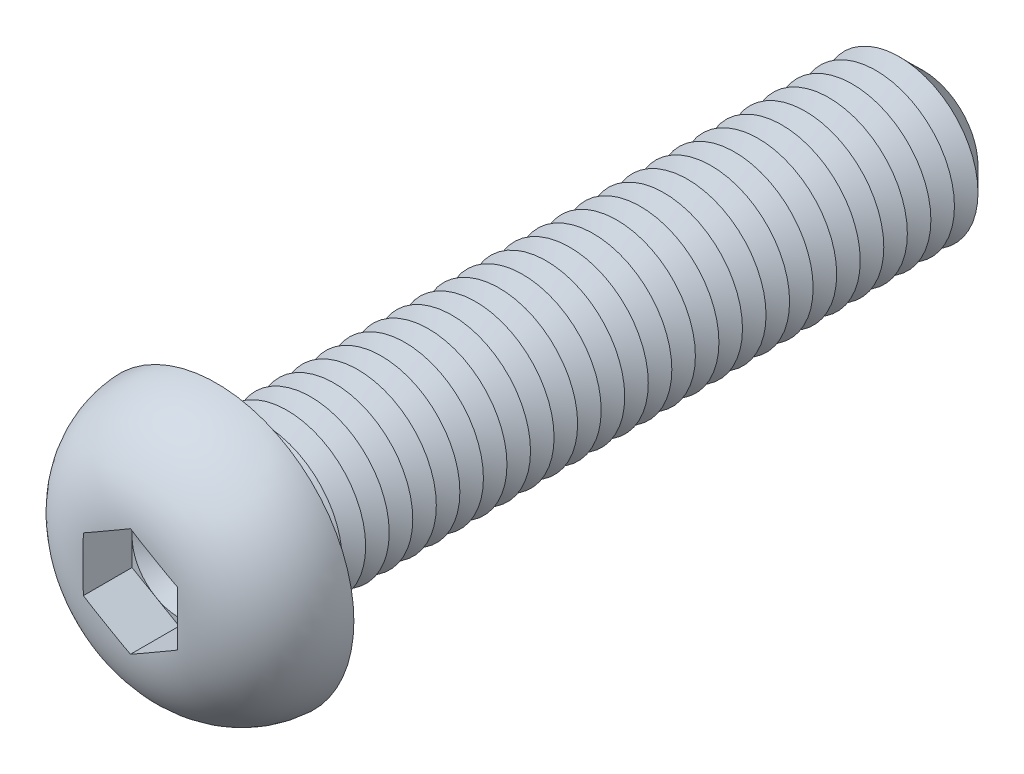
SolidWorks part; units mm, degrees
ref_plane "Front Plane" through (0, 0, 0) normal (0, 0, 1) x (1, 0, 0)
ref_plane "Top Plane" through (0, 0, 0) normal (0, 1, 0) x (1, 0, 0)
ref_plane "Right Plane" through (0, 0, 0) normal (1, 0, 0) x (0, 0, -1)
sketch "Sketch1" plane through (0, 0, 0) normal (1, 0, 0) x (0, 0, -1)
  line L0 (-47.9342, 0) -> (60.3146, 0) construction
sketch "Sketch2" plane through (0, 0, 0) normal (1, 0, 0) x (0, 0, -1)
  line L0 (0, 0) -> (-5.5, 0)
  line L1 (-47.9342, 0) -> (60.3146, 0) construction
  line L2 (-5.5, 0) -> (-5.5, 2.9578)
  line L3 (0, 8.75) -> (0, 0)
  arc A0 (-5.5, 2.9578) -> (0, 8.75) centre (0.3, 2.9578) cw
  dimension "D1" = 5.8
  dimension "D2" = 5.5
  dimension "D3" = 8.75
revolve "Revolve1" add sketch "Sketch2" angle 360 about L0
sketch "Sketch3" plane through (0, 0, 5.5) normal (0, 0, 1) x (1, 0, 0)
  line L1 (0, 3.4641) -> (-3, 1.7321)
  line L2 (-3, 1.7321) -> (-3, -1.7321)
  line L3 (-3, -1.7321) -> (0, -3.4641)
  line L4 (0, -3.4641) -> (3, -1.7321)
  line L5 (3, -1.7321) -> (3, 1.7321)
  line L6 (3, 1.7321) -> (0, 3.4641)
  circle A0 centre (0, 0) radius 3 construction
  dimension "D1" = 6
extrude "Cut-Extrude1" cut sketch "Sketch3" against normal blind 3.12
sketch "Sketch4" plane through (0, 0, 0) normal (0, 0, -1) x (-1, 0, 0)
  circle A0 centre (0, 0) radius 5
  dimension "D1" = 10
extrude "Boss-Extrude1" add sketch "Sketch4" along normal blind 45
chamfer "Chamfer1" distance 1.5 angle 45 1 edges at (-5, 0, -45)
sketch "Sketch5" plane through (0, 0, 0) normal (1, 0, 0) x (0, 0, -1)
  line L0 (1.5, 5) -> (3, 5)
  line L1 (43.5, 5) -> (0, 5) construction
  line L2 (3, 5) -> (2.25, 3.701)
  line L3 (2.25, 3.701) -> (1.5, 5)
  line L4 (0, -8.75) -> (0, 8.75) construction
  line L5 (43.5, 5) -> (0, 5) construction
  dimension "D1" = 1.5
  dimension "D2" = 1.5
revolve "Cut-Revolve1" cut sketch "Sketch5" angle 360 about L0
pattern_linear "LPattern1" count 28 spacing 1.5 along (0, 0, -1) of "Cut-Revolve1"
fillet "Fillet2" radius 0.6 1 edges at (5, 0, 0)
sketch "Sketch6" plane through (0, 0, 2.38) normal (0, 0, 1) x (1, 0, 0)
  line L0 (0, -3.4641) -> (3, -1.7321) construction
  circle A0 centre (0, 0) radius 3
extrude "Cut-Extrude2" cut sketch "Sketch6" against normal through all draft 60
